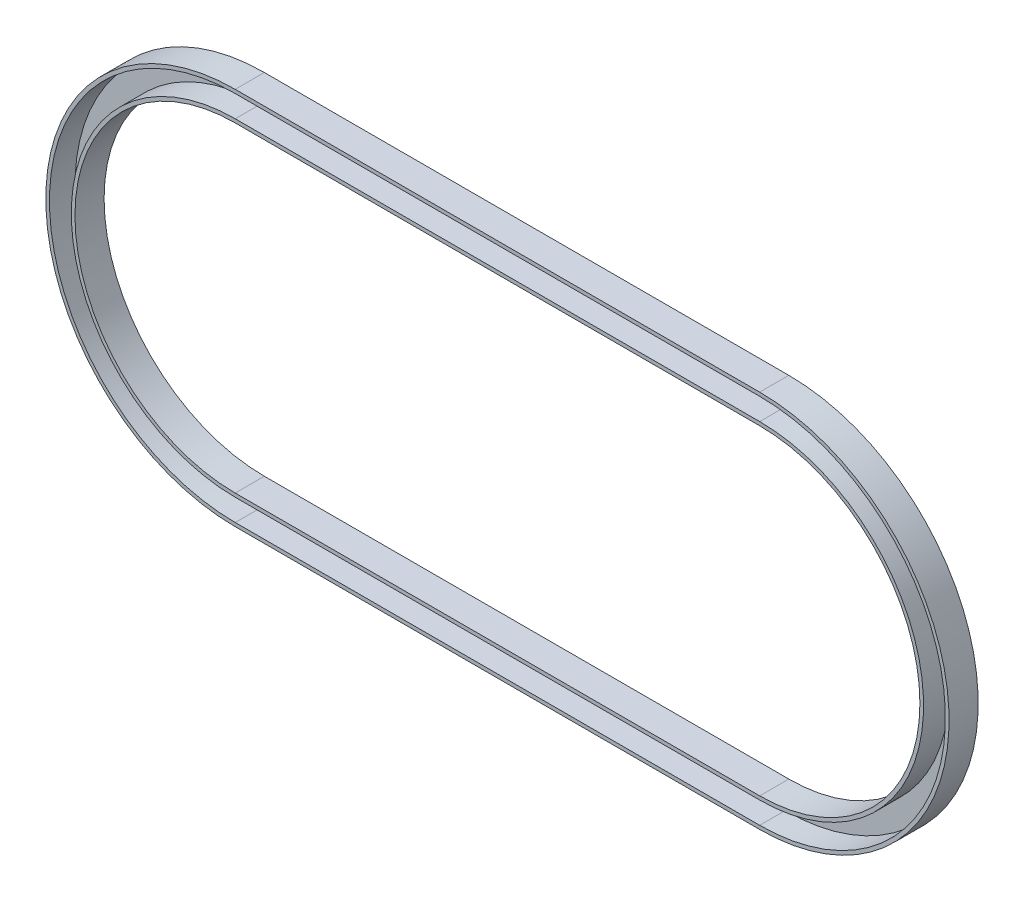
SolidWorks part; units mm, degrees
ref_plane "Plane1" through (0, 0, 0) normal (0, 0, 1) x (1, 0, 0)
ref_plane "Plane2" through (0, 0, 0) normal (0, 1, 0) x (1, 0, 0)
ref_plane "Plane3" through (0, 0, 0) normal (1, 0, 0) x (0, 0, -1)
sketch "Sketch1" plane through (0, 0, 0) normal (0, 0, 1) x (1, 0, 0)
  line L0 (457.2, 165.1) -> (0, 165.1)
  line L1 (457.2, 139.7) -> (0, 139.7)
  line L2 (0, -139.7) -> (457.2, -139.7)
  line L13 (0, -165.1) -> (457.2, -165.1)
  arc A0 (0, 139.7) -> (0, -139.7) centre (0, 0) ccw
  arc A1 (457.2, -139.7) -> (457.2, 139.7) centre (457.2, 0) ccw
  arc A2 (457.2, -165.1) -> (457.2, 165.1) centre (457.2, 0) ccw
  arc A3 (0, 165.1) -> (0, -165.1) centre (0, 0) ccw
  dimension "D1" = 330.2
  dimension "D2" = 457.2
  dimension "D3" = 25.4
extrude "Base-Extrude" add sketch "Sketch1" along normal blind 25.4
shell "Shell1" thickness 3.175
